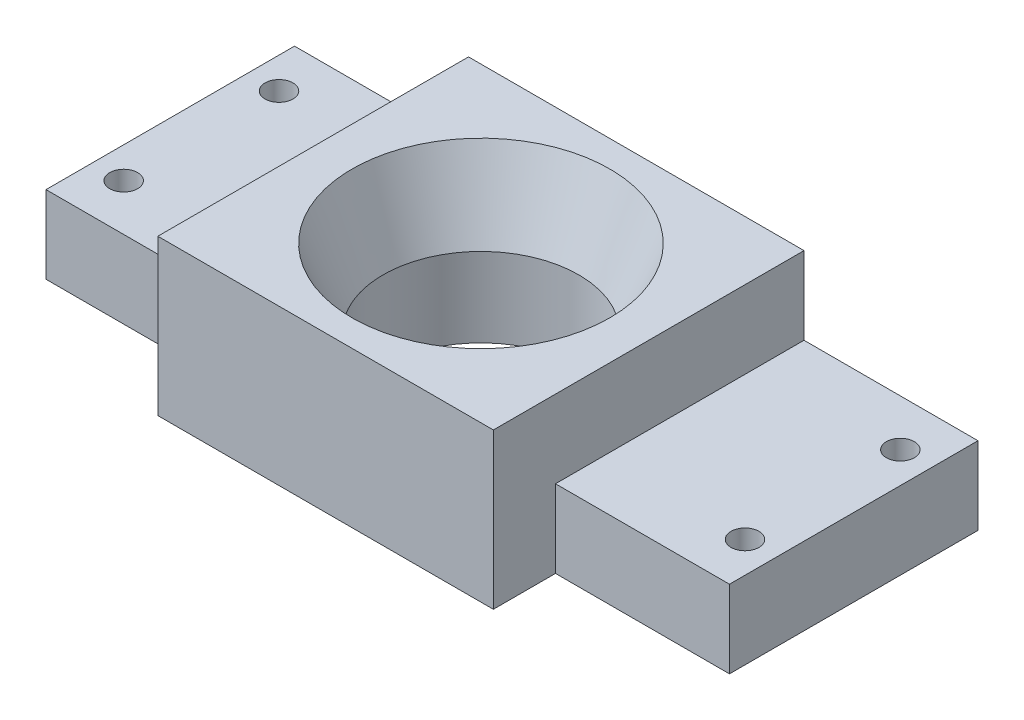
SolidWorks part; units mm, degrees
ref_plane "Face" through (0, 0, 0) normal (0, 0, 1) x (1, 0, 0)
ref_plane "Dessus" through (0, 0, 0) normal (0, 1, 0) x (1, 0, 0)
ref_plane "Droite" through (0, 0, 0) normal (1, 0, 0) x (0, 0, -1)
sketch "Esquisse1" plane through (0, 0, 0) normal (0, 1, 0) x (1, 0, 0)
  line L0 (-108, 100) -> (108, -100) construction
  line L1 (-108, -100) -> (108, -100)
  line L2 (-108, -100) -> (-108, 100)
  line L3 (-108, 100) -> (108, 100)
  line L4 (108, -100) -> (108, 100)
  dimension "D1" = 216
  dimension "D2" = 200
extrude "Boss.-Extru.1" add sketch "Esquisse1" along normal blind 100
sketch "Esquisse2" plane through (0, 0, 0) normal (0, 0, 1) x (1, 0, 0)
  line L0 (0, 0) -> (0, 100)
  line L1 (-108, 100) -> (108, 100) construction
  line L2 (0, 100) -> (-83, 100)
  line L3 (-83, 100) -> (-63, 51)
  line L4 (-63, 51) -> (-63, 0)
  line L5 (-108, 0) -> (108, 0) construction
  line L6 (-63, 0) -> (0, 0)
  dimension "D1" = 63
  dimension "D2" = 83
  dimension "D3" = 49
revolve "Enlèvement de matière-Révolution1" cut sketch "Esquisse2" angle 360 about L0
sketch "Esquisse4" plane through (0, 0, 0) normal (0, 1, 0) x (1, 0, 0)
  line L1 (-108, 100) -> (-220, 100)
  line L2 (-108, 100) -> (-108, -60)
  line L3 (-108, -60) -> (-220, -60)
  line L4 (-220, 100) -> (-220, -60)
  circle A0 centre (-200, 70) radius 9
  circle A1 centre (-200, -30) radius 9
  dimension "D3" = 18
  dimension "D1" = 112
  dimension "D2" = 160
  dimension "D4" = 20
  dimension "D5" = 100
  dimension "D6" = 30
extrude "Boss.-Extru.2" add sketch "Esquisse4" along normal blind 50
mirror "Symétrie1" about plane through (0, 0, 0) normal (1, 0, 0) of "Boss.-Extru.2"
